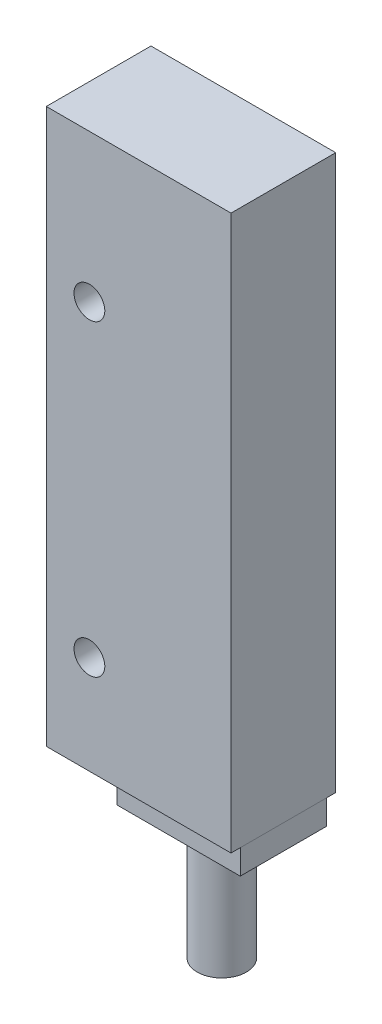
SolidWorks part; units mm, degrees
ref_plane "Face" through (0, 0, 0) normal (0, 0, 1) x (1, 0, 0)
ref_plane "Dessus" through (0, 0, 0) normal (0, 1, 0) x (1, 0, 0)
ref_plane "Droite" through (0, 0, 0) normal (1, 0, 0) x (0, 0, -1)
sketch "Esquisse1" plane through (0, 0, 0) normal (0, 0, 1) x (1, 0, 0)
  line L1 (-15, 22.5) -> (0, 22.5)
  line L2 (-15, 22.5) -> (-15, -22.5)
  line L3 (-15, -22.5) -> (0, -22.5)
  line L4 (0, 22.5) -> (0, -22.5)
  circle A0 centre (-11.5, 10.5) radius 1.25
  circle A1 centre (-11.5, -14.5) radius 1.25
  dimension "D3" = 25
  dimension "D5" = 2.5
  dimension "D1" = 15
  dimension "D2" = 45
  dimension "D4" = 12
  dimension "D6" = 3.5
extrude "Extrusion1" add sketch "Esquisse1" along normal mid plane 8.5
sketch "Esquisse2" plane through (0, 0, 0) normal (0, 0, 1) x (1, 0, 0)
  line L0 (-5, -22.5) -> (-5, -51.5042) construction
  line L1 (0, -22.5) -> (-10, -22.5)
  line L2 (0, -22.5) -> (0, -24.5)
  line L3 (0, -24.5) -> (-10, -24.5)
  line L4 (-10, -22.5) -> (-10, -24.5)
  line L5 (-15, 22.5) -> (-15, -22.5) construction
  dimension "D1" = 10
  dimension "D2" = 2
extrude "Extrusion2" add sketch "Esquisse2" along normal mid plane 7 separate body
sketch "Esquisse3" plane through (0, -24.5, 0) normal (0, -1, 0) x (1, 0, 0)
  line L0 (-15, 4.25) -> (-15, -4.25) construction
  circle A0 centre (-5, 0) radius 2
  dimension "D2" = 4
  dimension "D1" = 10
extrude "Extrusion3" add sketch "Esquisse3" along normal blind 10
sketch "Esquisse4" plane through (-15, 0, 0) normal (-1, 0, 0) x (0, 0, 1)
  line L0 (4.25, 22.5) -> (-4.25, 22.5) construction
  circle A0 centre (0, 17.5) radius 2.5
  dimension "D2" = 5
  dimension "D1" = 5
ref_plane "Plan1" through (0, 17.5, 0) normal (0, 1, 0) x (-1, 0, 0)
extrude "Extrusion4" add sketch "Esquisse4" along normal blind 0.5
